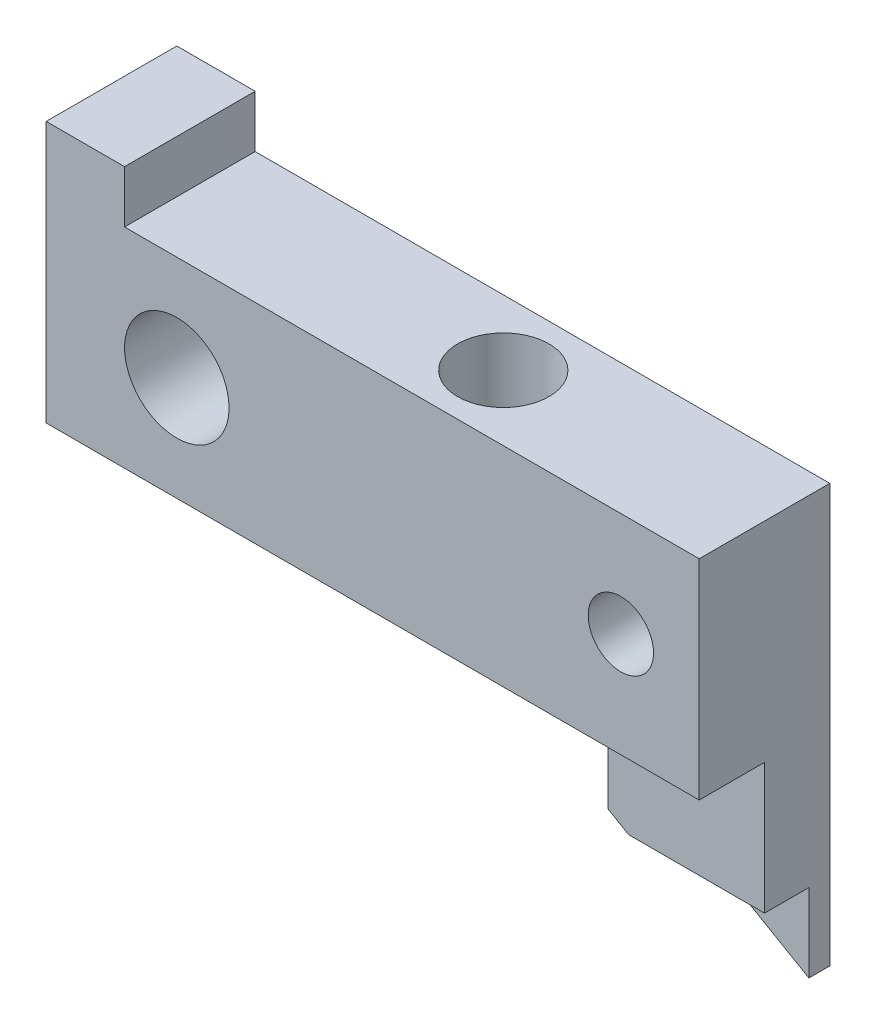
SolidWorks part; units mm, degrees
ref_plane "前视基准面" through (0, 0, 0) normal (0, 0, 1) x (1, 0, 0)
ref_plane "上视基准面" through (0, 0, 0) normal (0, 1, 0) x (1, 0, 0)
ref_plane "右视基准面" through (0, 0, 0) normal (1, 0, 0) x (0, 0, -1)
sketch "草图2" plane through (0, 0, 0) normal (0, 0, 1) x (1, 0, 0)
  line L0 (19, 3.4641) -> (25, 0)
  line L1 (25, 0) -> (25, 16)
  line L2 (0, 8) -> (0, 18)
  line L3 (3, 16) -> (25, 16)
  line L4 (0, 8) -> (19, 8)
  line L5 (0, 18) -> (3, 18)
  line L6 (3, 16) -> (3, 18)
  line L7 (19, 3.4641) -> (19, 8)
  circle A0 centre (5, 12) radius 2
extrude "凸台-拉伸1" add sketch "草图2" along normal blind 5
sketch "草图3" plane through (25, 0, 0) normal (1, 0, 0) x (0, 0, -1)
  line L0 (-0.8, 0) -> (0, 0)
  line L1 (-2.5, 3) -> (-0.8, 3)
  line L2 (-5, 8) -> (-2.5, 8)
  line L3 (-5, 18) -> (0, 18)
  line L4 (-0.8, 0) -> (-0.8, 3)
  line L5 (0, 0) -> (0, 18)
  line L6 (-5, 8) -> (-5, 18)
  line L7 (-2.5, 3) -> (-2.5, 8)
extrude "切除-拉伸1" cut sketch "草图3" against normal through all flip side to cut
sketch "草图4" plane through (0, 0, 5) normal (0, 0, 1) x (1, 0, 0)
  circle A0 centre (22, 12) radius 1.25
extrude "切除-拉伸2" cut sketch "草图4" against normal blind 5
sketch "草图5" plane through (0, 16, 0) normal (0, 1, 0) x (1, 0, 0)
  circle A0 centre (15, -2.5) radius 1.75
extrude "切除-拉伸3" cut sketch "草图5" against normal blind 3
